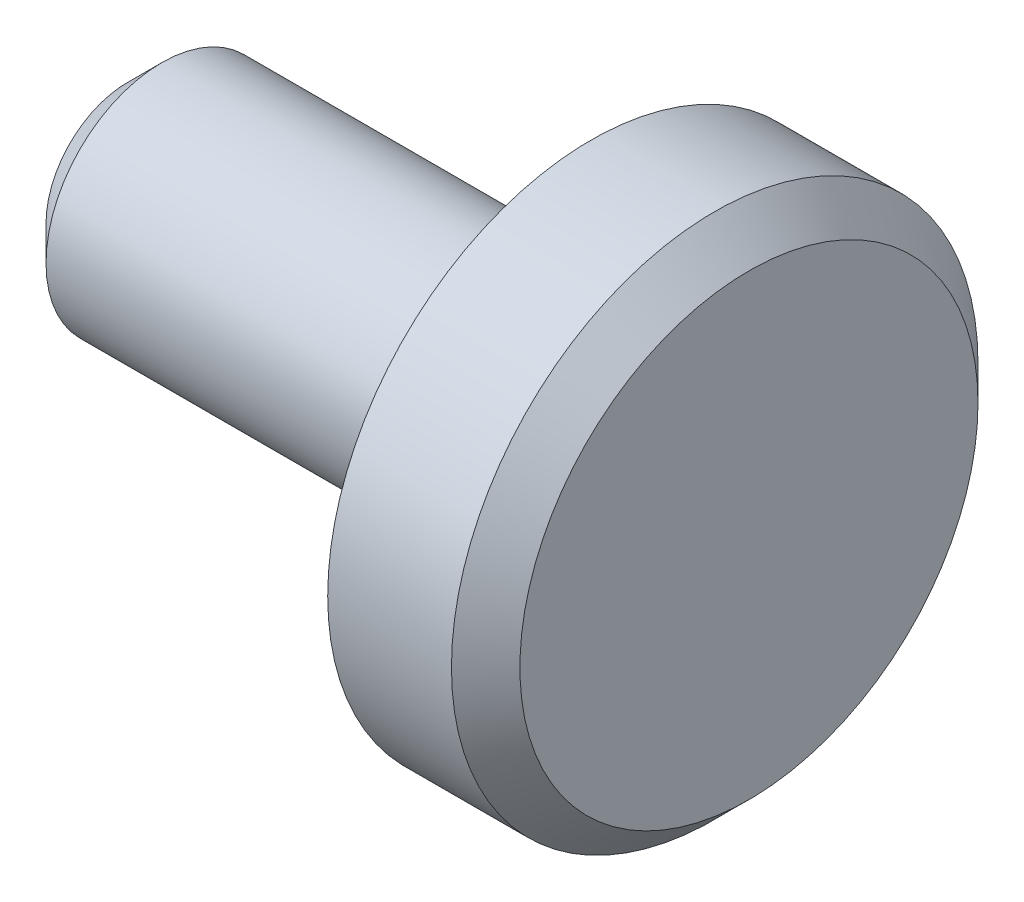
SolidWorks part; units mm, degrees
ref_plane "Front Plane" through (0, 0, 0) normal (0, 0, 1) x (1, 0, 0)
ref_plane "Top Plane" through (0, 0, 0) normal (0, 1, 0) x (1, 0, 0)
ref_plane "Right Plane" through (0, 0, 0) normal (1, 0, 0) x (0, 0, -1)
sketch "Sketch1" plane through (0, 0, 0) normal (0, 0, 1) x (1, 0, 0)
  line L0 (0, 0) -> (-19.07, 0) construction
  line L1 (0, 0) -> (-14.986, 0)
  line L2 (-14.986, 0) -> (-14.986, 2.794)
  line L3 (-14.986, 2.794) -> (-3.81, 2.794)
  line L4 (-3.81, 2.794) -> (-3.81, 6.35)
  line L5 (-3.81, 6.35) -> (0, 6.35)
  line L6 (0, 6.35) -> (0, 0)
  dimension "D1" = 14.986
  dimension "D2" = 3.81
  dimension "D3" = 6.35
  dimension "D4" = 2.794
revolve "Revolve1" add sketch "Sketch1" angle 360 about L0
chamfer "Chamfer1" distance 0.8255 angle 45 2 edges at (0, 0, -6.35) (-14.986, 0, -2.794)
